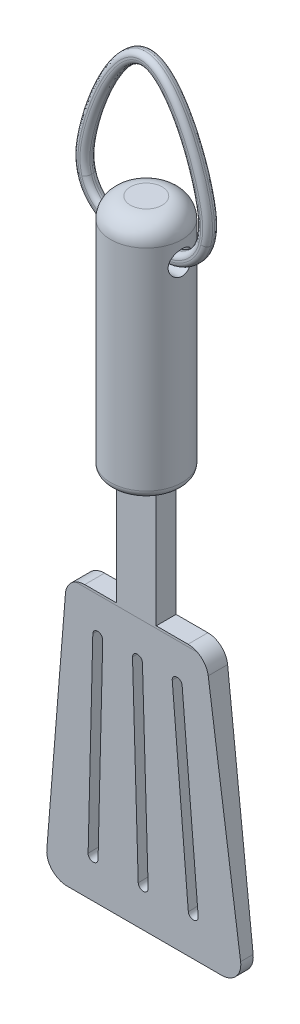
SolidWorks part; units mm, degrees
ref_plane "Front Plane" through (0, 0, 0) normal (0, 0, 1) x (1, 0, 0)
ref_plane "Top Plane" through (0, 0, 0) normal (0, 1, 0) x (1, 0, 0)
ref_plane "Right Plane" through (0, 0, 0) normal (1, 0, 0) x (0, 0, -1)
sketch "Sketch1" plane through (0, 0, 0) normal (0, 0, 1) x (1, 0, 0)
  line L1 (-22.5, 0) -> (22.5, 0)
  line L2 (-22.5, 0) -> (-22.5, 70)
  line L3 (-22.5, 70) -> (22.5, 70)
  line L4 (22.5, 0) -> (22.5, 70)
extrude "Boss-Extrude1" add sketch "Sketch1" along normal blind 5
sketch "Sketch2" plane through (0, 0, 0) normal (0, 0, 1) x (1, 0, 0)
  line L1 (-5, 55) -> (5, 55)
  line L2 (-5, 55) -> (-5, 100)
  line L3 (-5, 100) -> (5, 100)
  line L4 (5, 55) -> (5, 100)
extrude "Boss-Extrude2" add sketch "Sketch2" along normal blind 5
chamfer "Chamfer1" distance 3 angle 87.5 1 edges at (0, 0, 5)
fillet "Fillet1" radius 1 1 edges at (0, 0, 2)
fillet "Fillet2" radius 5 2 edges at (-22.5, 70, 2.5) (22.5, 70, 2.5)
ref_plane "Plane1" through (0, 0, 2.5) normal (0, 0, 1) x (1, 0, 0)
sketch "Sketch3" plane through (0, 0, 2.5) normal (0, 0, 1) x (1, 0, 0)
  line L0 (0, 160) -> (0, 100)
  line L1 (-9, 100) -> (0, 100)
  line L2 (-9, 100) -> (-9, 160)
  line L3 (-9, 160) -> (0, 160)
revolve "Revolve1" add sketch "Sketch3" angle 360 about L0
fillet "Fillet3" radius 5 1 edges at (0, 160, 11.5)
fillet "Fillet4" radius 2 1 edges at (0, 100, 11.5)
sketch "Sketch5" plane through (0, 0, 0) normal (1, 0, 0) x (0, 0, -1)
  line L0 (-2.5, 155) -> (-2.5, 150) construction
  line L1 (-11.5, 155) -> (6.5, 155) construction
  circle A0 centre (-2.5, 150) radius 3
extrude "Cut-Extrude2" cut sketch "Sketch5" against normal through all both and the other way through all
sketch "Sketch6" plane through (0, 0, 2.5) normal (0, 0, 1) x (1, 0, 0)
  line L0 (0, 150.2173) -> (-5.3175, 150.2173)
  line L1 (0, 150.2173) -> (5.2967, 150.2173)
  line L2 (-15, 150.0529) -> (-15, 165.3816) construction
  line L3 (15, 150.2173) -> (15, 165.3816) construction
  line L4 (0, 150.2173) -> (0, 190.2173) construction
  line L5 (-15, 165.3816) -> (-15.0393, 165.3816) construction
  line L6 (15, 165.3816) -> (15.0393, 165.3816) construction
  arc A0 (15, 157.7994) -> (5.2967, 150.2173) centre (5.2967, 160.2173) cw
  arc A1 (-5.3175, 150.2173) -> (-15, 157.7173) centre (-5.3175, 160.2173) cw
  spline S0 degree 3 poles (-15, 157.7173) (-15.7044, 160.4455) (-14.8942, 171.4537) (-0.0248, 205.0519) (14.9382, 171.5215) (15.6681, 160.4806) (15, 157.7994) knots 0.094356 0.094356 0.094356 0.094356 0.179225 0.500721 0.822217 0.906176 0.906176 0.906176 0.906176
  dimension "D1" = 10
extrude "Extrude-Thin1" add sketch "Sketch6" along normal mid plane 3 separate body thin
fillet "Fillet5" radius 1.25 16 edges at (10.5303, 153.5195, 1) (-0.0104, 151.7173, 1) (-10.5227, 153.4974, 1) (12.3775, 151.1556, 1) (-0.0104, 148.7173, 1) (12.3775, 151.1556, 4) (-0.0104, 148.7173, 4) (10.5303, 153.5195, 4) (-0.0104, 151.7173, 4) (-10.5227, 153.4974, 4) (-12.3598, 151.1257, 1) (-12.3598, 151.1257, 4)
sketch "Sketch9" plane through (0, 0, 5) normal (0, 0, 1) x (1, 0, 0)
  line L1 (-28.9283, 70) -> (30.5502, 70)
  line L2 (-28.9283, 70) -> (-28.9283, -4.9338)
  line L3 (-28.9283, -4.9338) -> (30.5502, -4.9338)
  line L4 (30.5502, 70) -> (30.5502, -4.9338)
extrude "Cut-Extrude5" cut sketch "Sketch9" against normal through all contours L1 L4 L3 L2
sketch "Sketch10" plane through (0, 0, 5) normal (0, 0, 1) x (1, 0, 0)
  line L2 (-19.4357, 0) -> (19.4357, 0)
  line L3 (-13.0071, 70) -> (13.0071, 70)
  line L4 (17.9786, 65.5327) -> (24.4072, 5.5327)
  line L5 (-17.9786, 65.5327) -> (-24.4072, 5.5327)
  arc A0 (-17.9786, 65.5327) -> (-13.0071, 70) centre (-13.0071, 65) cw
  arc A1 (17.9786, 65.5327) -> (13.0071, 70) centre (13.0071, 65) ccw
  arc A2 (19.4357, 0) -> (24.4072, 5.5327) centre (19.4357, 5) ccw
  arc A3 (-19.4357, 0) -> (-24.4072, 5.5327) centre (-19.4357, 5) cw
  point P11 (-17.5, 70)
  point P14 (17.5, 70)
  point P17 (25, 0)
  point P20 (-25, 0)
  dimension "D1" = 5
  dimension "D2" = 5
extrude "Boss-Extrude3" add sketch "Sketch10" against normal blind 5
chamfer "Chamfer2" distance 2 angle 88.35 1 edges at (0, 0, 5)
sketch "Sketch11" plane through (0, -0.0863, 2.9975) normal (0, -0.0288, 0.9996) x (1, 0, 0)
  line L0 (12.6168, 10.1171) -> (10, 60.0486) construction
  line L1 (0, 70.0486) -> (0, 60.0486) construction
  line L2 (11.3685, 10.0517) -> (8.7517, 59.9832)
  line L3 (13.8651, 10.1826) -> (11.2483, 60.114)
  line L4 (0, 10.0486) -> (0, 60.0486) construction
  line L5 (-1.25, 10.0486) -> (-1.25, 60.0486)
  line L6 (1.25, 10.0486) -> (1.25, 60.0486)
  line L7 (-12.6168, 10.1171) -> (-10, 60.0486) construction
  line L8 (-13.8651, 10.1826) -> (-11.2483, 60.114)
  line L9 (-11.3685, 10.0517) -> (-8.7517, 59.9832)
  arc A0 (11.3685, 10.0517) -> (13.8651, 10.1826) centre (12.6168, 10.1171) ccw
  arc A1 (11.2483, 60.114) -> (8.7517, 59.9832) centre (10, 60.0486) ccw
  arc A2 (-1.25, 10.0486) -> (1.25, 10.0486) centre (0, 10.0486) ccw
  arc A3 (1.25, 60.0486) -> (-1.25, 60.0486) centre (0, 60.0486) ccw
  arc A4 (-13.8651, 10.1826) -> (-11.3685, 10.0517) centre (-12.6168, 10.1171) ccw
  arc A5 (-8.7517, 59.9832) -> (-11.2483, 60.114) centre (-10, 60.0486) ccw
  point P4 (11.3084, 35.0829)
  point P11 (0, 35.0486)
  point P18 (-11.3084, 35.0829)
extrude "Cut-Extrude6" cut sketch "Sketch11" against normal through all
